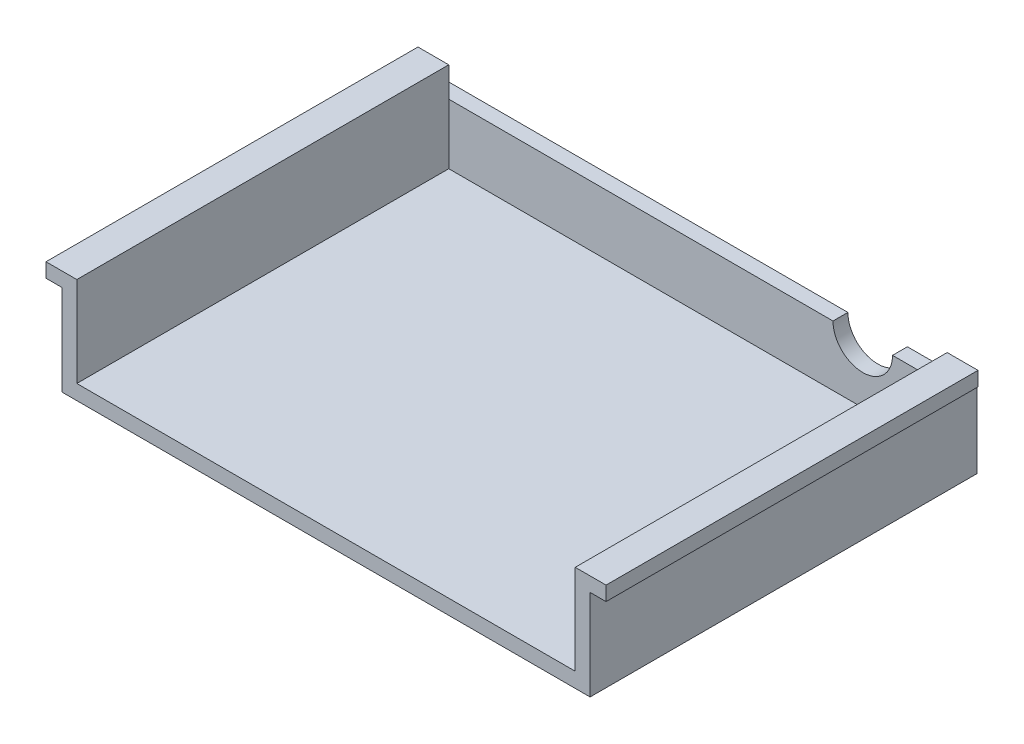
SolidWorks part; units mm, degrees
ref_plane "Front Plane" through (0, 0, 0) normal (0, 0, 1) x (1, 0, 0)
ref_plane "Top Plane" through (0, 0, 0) normal (0, 1, 0) x (1, 0, 0)
ref_plane "Right Plane" through (0, 0, 0) normal (1, 0, 0) x (0, 0, -1)
sketch "Sketch1" plane through (0, 0, 0) normal (0, 0, 1) x (1, 0, 0)
  line L0 (-33.1262, -3.7069) -> (2.9418, -3.7069)
  line L1 (-33.1262, -3.7069) -> (-33.1262, 2.4786)
  line L2 (-34.2141, 3.4559) -> (-32.1102, 3.4559)
  line L3 (-34.2141, 3.4559) -> (-34.2141, 2.4786)
  line L4 (-34.2141, 2.4786) -> (-33.1262, 2.4786)
  line L6 (1.9258, -2.6909) -> (1.9258, 3.4559)
  line L7 (-32.1102, -2.6909) -> (-32.1102, 3.4559)
  line L8 (4.0297, 3.4559) -> (1.9258, 3.4559)
  line L9 (-33.1262, -3.7069) -> (-33.1262, 3.4559) construction
  line L10 (4.0297, 2.4786) -> (2.9418, 2.4786)
  line L11 (4.0297, 3.4559) -> (4.0297, 2.4786)
  line L12 (4.0297, 3.4559) -> (3.9578, 3.4559)
  line L13 (2.9418, -3.7069) -> (2.9418, 2.4786)
  line L14 (3.9578, -3.7069) -> (-33.1262, -3.7069) construction
  line L15 (3.9578, -2.6909) -> (-32.1102, -2.6909) construction
  line L16 (-32.1102, -2.6909) -> (1.9258, -2.6909)
extrude "Boss-Extrude1" add sketch "Sketch1" along normal blind 25.4 contours L16 L7 L2 L3 L4 L1 L0 L13 L10 L11 L8 L6
sketch "Sketch2" plane through (0, 0, 0) normal (0, 0, -1) x (-1, 0, 0)
  line L0 (-2.9418, 1.4239) -> (-2.9418, -3.7069)
  line L3 (-2.9418, -3.7069) -> (-2.9418, 2.4786) construction
  line L4 (-2.9418, -3.7069) -> (33.1262, -3.7069)
  line L5 (33.1262, -3.7069) -> (33.1262, 1.4239)
  line L6 (33.1262, -3.7069) -> (33.1262, 2.4786) construction
  line L7 (33.1262, 1.4239) -> (-2.9986, 1.4239)
extrude "Boss-Extrude2" add sketch "Sketch2" along normal blind 1.016 contours L7 M12 M2 M1 | L7 M8 M12 M1 M2 M6 M7
sketch "Sketch4" plane through (0, 0, -1.016) normal (0, 0, -1) x (-1, 0, 0)
  line L0 (-2.9418, 1.4239) -> (3.84, 1.4239)
  line L1 (33.1262, 1.4239) -> (-2.9418, 1.4239) construction
  circle A0 centre (3.84, 1.4239) radius 2.032
extrude "Cut-Extrude1" cut sketch "Sketch4" against normal blind 3.048 contours A0 M1
